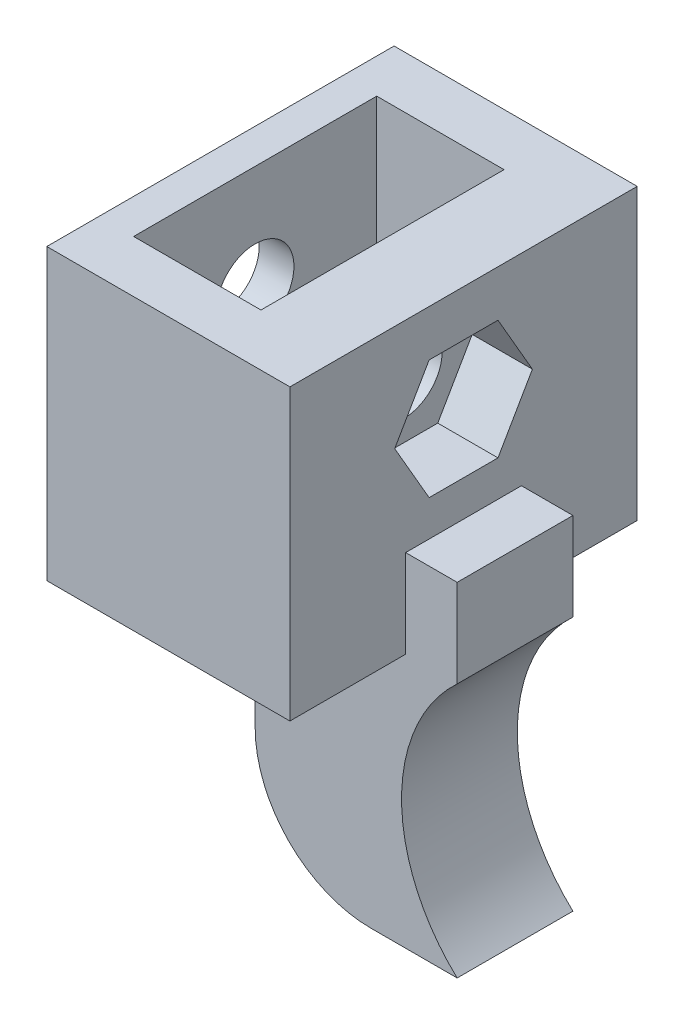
SolidWorks part; units mm, degrees
ref_plane "Front Plane" through (0, 0, 0) normal (0, 0, 1) x (1, 0, 0)
ref_plane "Top Plane" through (0, 0, 0) normal (0, 1, 0) x (1, 0, 0)
ref_plane "Right Plane" through (0, 0, 0) normal (1, 0, 0) x (0, 0, -1)
sketch "Sketch2" plane through (0, 0, 0) normal (0, 0, 1) x (1, 0, 0)
  line L0 (-33, -12.1745) -> (-12, -12.1745)
  line L9 (-12, -12.1745) -> (-12, -29.5727)
  line L10 (-12, -29.5727) -> (-7.5522, -29.5727)
  line L11 (-7.5522, -29.5727) -> (-7.5522, -37.1745)
  line L14 (-25, -37.1745) -> (-25, -49.1745)
  line L15 (-15, -59.1745) -> (-7.5522, -59.1745)
  line L16 (-33, -12.1745) -> (-33, -37.1745)
  line L17 (-33, -37.1745) -> (-25, -37.1745)
  arc A3 (-7.5522, -37.1745) -> (-7.5522, -59.1745) centre (2.6459, -48.1745) ccw
  arc A4 (-15, -59.1745) -> (-25, -49.1745) centre (-15, -49.1745) cw
  point P11 (-25, -59.1745)
  dimension "D9" = 17.4478
  dimension "D8" = 10
  dimension "D6" = 15
  dimension "D2" = 12.1745
  dimension "D3" = 21
  dimension "D4" = 17.3982
  dimension "D5" = 25
  dimension "D7" = 22
  dimension "D10" = 12
  dimension "D11" = 8
extrude "Boss-Extrude1" add sketch "Sketch2" against normal mid plane 30
sketch "Sketch3" plane through (0, -12.1745, 0) normal (0, 1, 0) x (1, 0, 0)
  line L1 (-30, 10.5) -> (-19, 10.5)
  line L2 (-30, 10.5) -> (-30, -10.5)
  line L3 (-30, -10.5) -> (-19, -10.5)
  line L4 (-19, 10.5) -> (-19, -10.5)
  line L5 (-33, 15) -> (-33, -15) construction
  point P4 (-19, 0)
  dimension "D1" = 11
  dimension "D2" = 21
  dimension "D3" = 3
extrude "Cut-Extrude1" cut sketch "Sketch3" against normal blind 18.3 contours L2 L1 L4 L3
sketch "Sketch7" plane through (0, -59.1745, 0) normal (0, -1, 0) x (1, 0, 0)
  line L0 (-7.5522, -15) -> (-7.5522, 15) construction
  line L9 (-33, 15) -> (-7.5522, 15)
  line L14 (-33, 15) -> (-33, 5)
  line L22 (-33, 5) -> (-7.5522, 5)
  line L23 (-7.5522, 15) -> (-7.5522, 5)
  line L29 (55, 0) -> (-55, 0) construction
  line L30 (-33, -5) -> (-7.5522, -5)
  line L31 (-7.5522, -15) -> (-7.5522, -5)
  line L32 (-33, -15) -> (-7.5522, -15)
  line L33 (-33, -15) -> (-33, -5)
  dimension "D1" = 10
sketch "Sketch13" plane through (-30, 0, 0) normal (1, 0, 0) x (0, 0, -1)
  line L0 (-10.5, -12.1745) -> (10.5, -30.4745) construction
  line L1 (10.5, -12.1745) -> (-10.5, -30.4745) construction
  circle A0 centre (0, -21.3245) radius 3.35
  dimension "D1" = 6.7
extrude "Cut-Extrude7" cut sketch "Sketch7" against normal up to surface (22 mm away)
extrude "Cut-Extrude5" cut sketch "Sketch13" against normal through all both and the other way through all
sketch "Sketch14" plane through (-12, 0, 0) normal (1, 0, 0) x (0, 0, -1)
  line L1 (5.9467, -21.3245) -> (2.9734, -16.1745)
  line L2 (2.9734, -16.1745) -> (-2.9734, -16.1745)
  line L3 (-2.9734, -16.1745) -> (-5.9467, -21.3245)
  line L4 (-5.9467, -21.3245) -> (-2.9734, -26.4745)
  line L5 (-2.9734, -26.4745) -> (2.9734, -26.4745)
  line L6 (2.9734, -26.4745) -> (5.9467, -21.3245)
  circle A0 centre (0, -21.3245) radius 5.15 construction
  dimension "D1" = 10.3
extrude "Cut-Extrude6" cut sketch "Sketch14" against normal blind 5.2
sketch "Sketch15" plane through (0, -29.5727, 0) normal (0, 1, 0) x (1, 0, 0)
  line L0 (-7.5522, 15) -> (-7.5522, -15) construction
  line L1 (-12, 15) -> (-7.5522, 15)
  line L2 (-12, 15) -> (-12, 5)
  line L3 (-12, 5) -> (-7.5522, 5)
  line L4 (-7.5522, 15) -> (-7.5522, 5)
  line L5 (-55, 0) -> (55, 0) construction
  line L6 (-12, -5) -> (-7.5522, -5)
  line L7 (-7.5522, -15) -> (-7.5522, -5)
  line L8 (-12, -15) -> (-7.5522, -15)
  line L9 (-12, -15) -> (-12, -5)
  dimension "D1" = 10
extrude "Cut-Extrude8" cut sketch "Sketch15" against normal up to surface (7.6018 mm away)
